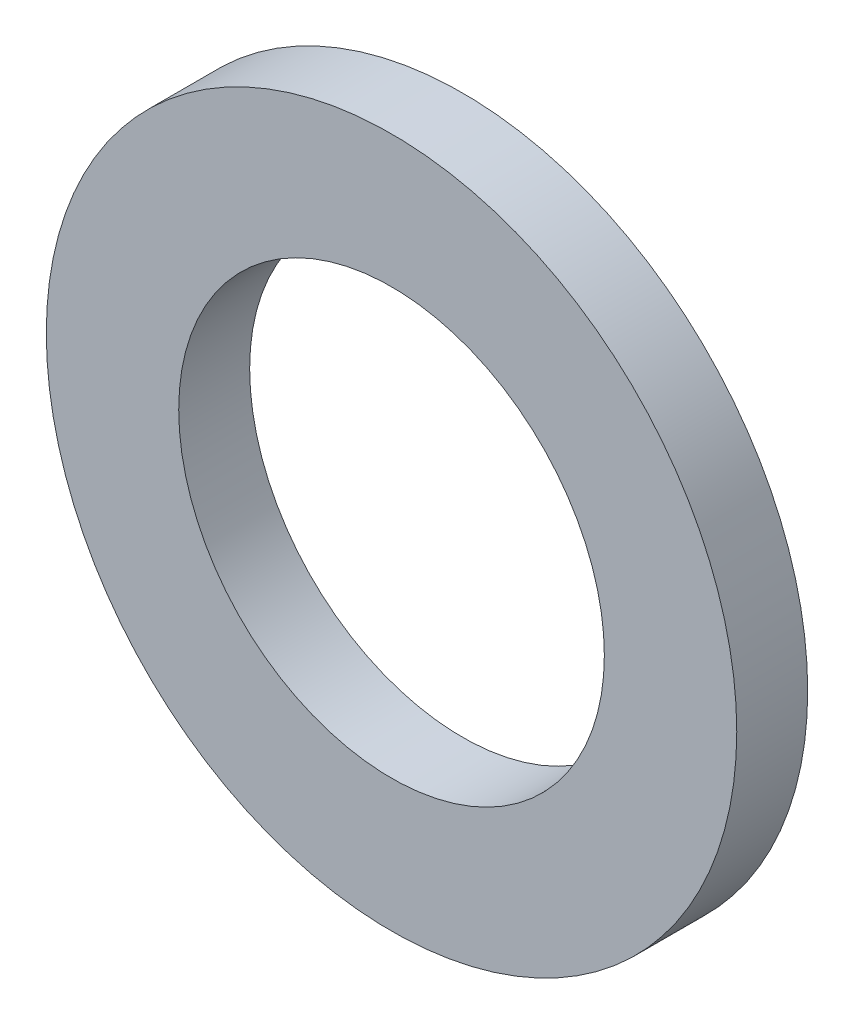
SolidWorks part; units mm, degrees
ref_plane "Front Plane" through (0, 0, 0) normal (0, 0, 1) x (1, 0, 0)
ref_plane "Top Plane" through (0, 0, 0) normal (0, 1, 0) x (1, 0, 0)
ref_plane "Right Plane" through (0, 0, 0) normal (1, 0, 0) x (0, 0, -1)
sketch "Schizzo1" plane through (0, 0, 0) normal (0, 0, 1) x (1, 0, 0)
  circle A0 centre (0, 0) radius 30
  circle A1 centre (0, 0) radius 48.6653
  dimension "D1" = 60
extrude "Extrusion1" add sketch "Schizzo1" along normal blind 10
ref_plane "Plane1" through (0, 0, 5) normal (0, 0, 1) x (1, 0, 0)
